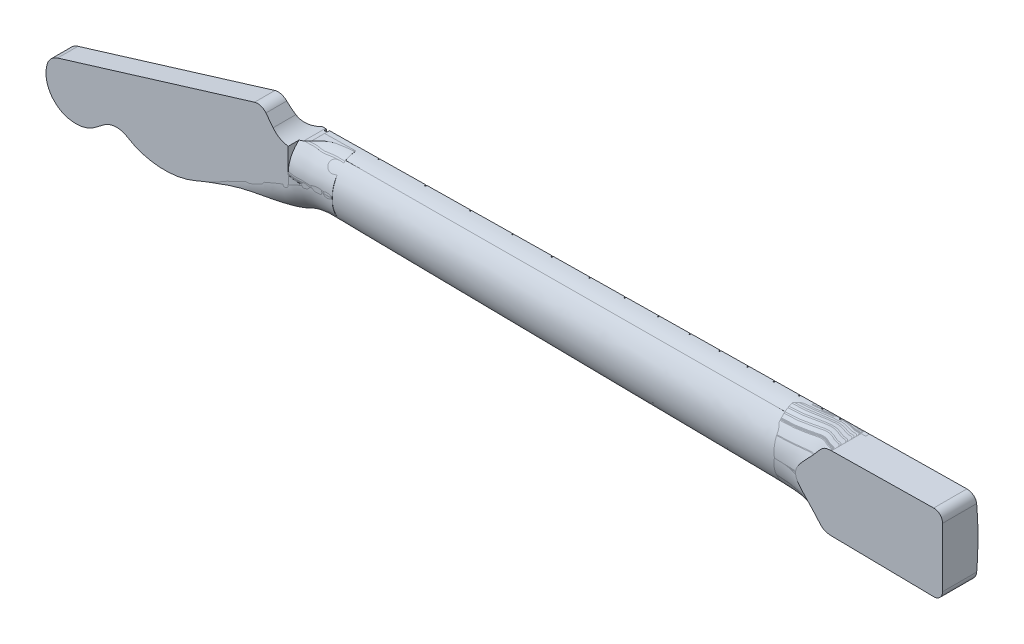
SolidWorks part; units mm, degrees
ref_plane "Ebene vorne" through (0, 0, 0) normal (0, 0, 1) x (1, 0, 0)
ref_plane "Ebene oben" through (0, 0, 0) normal (0, 1, 0) x (1, 0, 0)
ref_plane "Ebene rechts" through (0, 0, 0) normal (1, 0, 0) x (0, 0, -1)
imported_body "Part-1-1-solid1"
imported_body "Part-2-1-solid1"
imported_body "Part-3-1-solid1"
combine bodies "Kombinieren2" operation type add bodies to combine 101 102 103
sketch "Skizze2" plane through (0, 0, 0) normal (0, 1, 0) x (1, 0, 0)
  line L0 (574.1232, 25.654) -> (182.4696, 25.654) construction
  line L1 (218.4796, 25.654) -> (219.0796, 25.654) construction
  line L2 (218.4796, 25.654) -> (218.4796, 24.654)
  line L3 (218.4796, 24.654) -> (219.0796, 24.654)
  line L4 (219.0796, 25.654) -> (219.0796, 24.654)
  line L5 (218.4796, 25.654) -> (218.4796, 26.154)
  line L6 (218.4796, 26.154) -> (219.0796, 26.154)
  line L7 (219.0796, 26.154) -> (219.0796, 25.654)
  point P6 (218.7796, 25.654)
  dimension "D1" = 0.5
  dimension "D2" = 1
  dimension "D3" = 0.6
  dimension "D4" = 36.31
ref_plane "Ebene1" through (218.7796, 0, 0) normal (1, 0, 0) x (0, 0, -1)
sketch "Skizze5" plane through (218.7796, 0, 0) normal (1, 0, 0) x (0, 0, -1)
  arc A0 (24.7423, -20.9549) -> (24.7424, 20.955) centre (-215.646, 0.0007) ccw construction
  arc A1 (24.7423, -20.9549) -> (24.7424, 20.955) centre (-215.646, 0.0007) ccw construction
  circle A2 centre (-215.646, 0.0007) radius 241.3
  dimension "D1" = 482.6
sweep "Schnitt-Austragung2" cut profiles "Skizze2" path "Skizze5"
sketch "Skizze6" plane through (0, 0, 0) normal (0, 1, 0) x (1, 0, 0)
  line L0 (182.4696, 25.654) -> (651.332, 25.3682)
pattern_linear "Lineares Muster5" count 2 spacing 34.1 along (1, 0, 0.0006) of "Schnitt-Austragung2"
pattern_linear "Lineares Muster10" count 2 spacing 66.5 along (1, 0, 0.0006) of "Schnitt-Austragung2"
pattern_linear "Lineares Muster11" count 2 spacing 97 along (1, 0, 0.0006) of "Schnitt-Austragung2"
pattern_linear "Lineares Muster12" count 2 spacing 125.8 along (1, 0, 0.0006) of "Schnitt-Austragung2"
pattern_linear "Lineares Muster13" count 2 spacing 153 along (1, 0, 0.0006) of "Schnitt-Austragung2"
pattern_linear "Lineares Muster14" count 2 spacing 178.7 along (0, 0, 1) of "Schnitt-Austragung2"
pattern_linear "Lineares Muster15" count 2 spacing 202.9 along (0, 0, 1) of "Schnitt-Austragung2"
pattern_linear "Lineares Muster16" count 2 spacing 225.8 along (0, 0, 1) of "Schnitt-Austragung2"
pattern_linear "Lineares Muster17" count 2 spacing 247.4 along (0, 0, 1) of "Schnitt-Austragung2"
pattern_linear "Lineares Muster18" count 2 spacing 267.8 along (0, 0, 1) of "Schnitt-Austragung2"
pattern_linear "Lineares Muster19" count 2 spacing 287 along (0, 0, 1) of "Schnitt-Austragung2"
pattern_linear "Lineares Muster20" count 2 spacing 305.2 along (0, 0, 1) of "Schnitt-Austragung2"
pattern_linear "Lineares Muster24" count 2 spacing 322 along (0, 0, 1) of "Schnitt-Austragung2"
pattern_linear "Lineares Muster25" count 2 spacing 335 along (1, 0, 0.0006) of "Schnitt-Austragung2"
